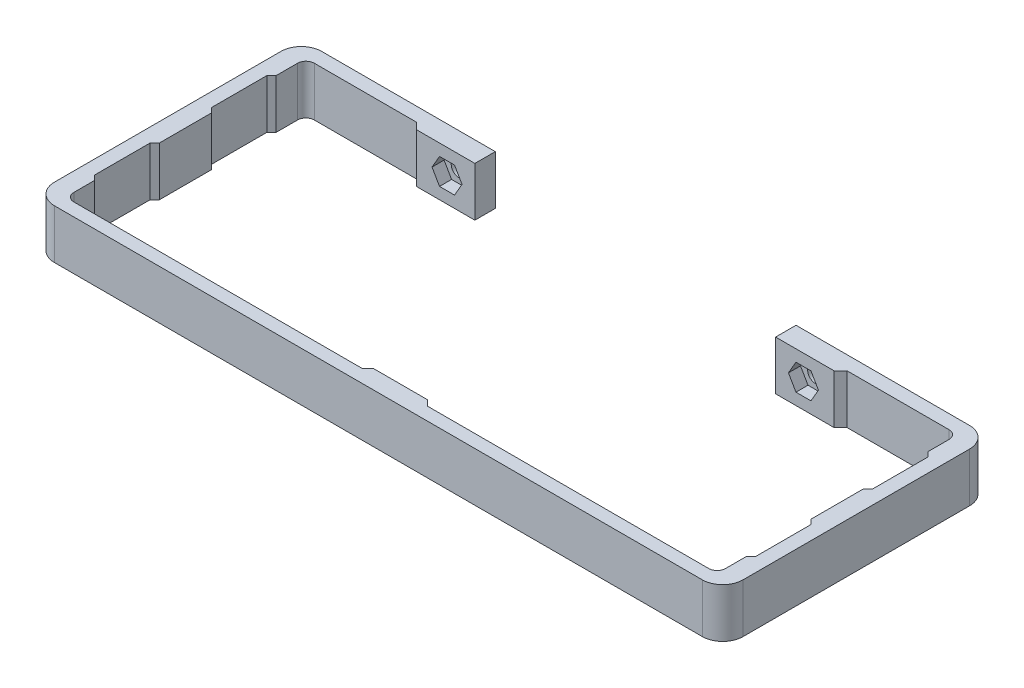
SolidWorks part; units mm, degrees
ref_plane "Front Plane" through (0, 0, 0) normal (0, 0, 1) x (1, 0, 0)
ref_plane "Top Plane" through (0, 0, 0) normal (0, 1, 0) x (1, 0, 0)
ref_plane "Right Plane" through (0, 0, 0) normal (1, 0, 0) x (0, 0, -1)
sketch "Sketch1" plane through (0, 0, 0) normal (0, 0, 1) x (1, 0, 0)
  line L1 (-27.0026, 47.8166) -> (121.3974, 47.8166)
  line L2 (-27.0026, 47.8166) -> (-27.0026, 37.2166)
  line L3 (-27.0026, 37.2166) -> (121.3974, 37.2166)
  line L4 (121.3974, 47.8166) -> (121.3974, 37.2166)
  dimension "D1" = 148.4
  dimension "D2" = 10.6
extrude "Boss-Extrude1" add sketch "Sketch1" along normal blind 4
ref_plane "Plane1" through (0, 0, 0) normal (0, 0, -1) x (-1, 0, 0)
sketch "Sketch2" plane through (0, 0, 0) normal (0, 0, -1) x (-1, 0, 0)
  line L0 (-121.3974, 47.8166) -> (27.0026, 47.8166) construction
  line L1 (-121.3974, 37.2166) -> (-117.3974, 37.2166)
  line L2 (-121.3974, 37.2166) -> (-121.3974, 47.8166)
  line L3 (-121.3974, 47.8166) -> (-117.3974, 47.8166)
  line L4 (-117.3974, 37.2166) -> (-117.3974, 47.8166)
  line L6 (27.0026, 37.2166) -> (23.0026, 37.2166)
  line L7 (27.0026, 37.2166) -> (27.0026, 47.8166)
  line L8 (27.0026, 47.8166) -> (23.0026, 47.8166)
  line L9 (23.0026, 37.2166) -> (23.0026, 47.8166)
  dimension "D1" = 4
  dimension "D2" = 4
extrude "Boss-Extrude2" add sketch "Sketch2" along normal blind 53.6
ref_plane "Plane2" through (0, 47.8166, 0) normal (0, 1, 0) x (1, 0, 0)
sketch "Sketch3" plane through (0, 47.8166, 0) normal (0, 1, 0) x (1, 0, 0)
  line L1 (-23.0026, 53.6) -> (14.7974, 53.6)
  line L2 (-23.0026, 53.6) -> (-23.0026, 49.2)
  line L3 (-23.0026, 49.2) -> (14.7974, 49.2)
  line L4 (14.7974, 53.6) -> (14.7974, 49.2)
  line L5 (117.3974, 53.6) -> (79.5974, 53.6)
  line L6 (117.3974, 53.6) -> (117.3974, 49.2)
  line L7 (117.3974, 49.2) -> (79.5974, 49.2)
  line L8 (79.5974, 53.6) -> (79.5974, 49.2)
  dimension "D1" = 4.4
  dimension "D2" = 4.4
  dimension "D3" = 37.8
  dimension "D4" = 37.8
extrude "Boss-Extrude3" add sketch "Sketch3" against normal blind 10.6
fillet "Fillet1" radius 4.4 4 edges at (121.3974, 42.5166, -53.6) (-27.0026, 42.5166, -53.6) (-27.0026, 42.5166, 4) (121.3974, 42.5166, 4)
ref_plane "Plane3" through (0, 0, -53.6) normal (0, 0, -1) x (-1, 0, 0)
sketch "Sketch4" plane through (0, 0, -53.6) normal (0, 0, -1) x (-1, 0, 0)
  line L0 (-14.7974, 37.2166) -> (-14.7974, 47.8166) construction
  line L1 (22.6026, 47.8166) -> (-14.7974, 47.8166) construction
  line L2 (-79.5974, 47.8166) -> (-116.9974, 47.8166) construction
  line L3 (-79.5974, 37.2166) -> (-79.5974, 47.8166) construction
  circle A0 centre (-8.7974, 42.5166) radius 1.7
  circle A1 centre (-85.5974, 42.5166) radius 1.7
  dimension "D1" = 3.4
  dimension "D2" = 3.4
  dimension "D3" = 6
  dimension "D4" = 5.3
  dimension "D5" = 5.3
  dimension "D6" = 6
extrude "Cut-Extrude1" cut sketch "Sketch4" against normal blind 10.6
ref_plane "Plane4" through (0, 0, -49.2) normal (0, 0, 1) x (1, 0, 0)
sketch "Sketch5" plane through (0, 0, -49.2) normal (0, 0, 1) x (1, 0, 0)
  line L1 (10.414, 39.7166) -> (12.0305, 42.5166)
  line L2 (12.0305, 42.5166) -> (10.414, 45.3166)
  line L3 (10.414, 45.3166) -> (7.1808, 45.3166)
  line L4 (7.1808, 45.3166) -> (5.5642, 42.5166)
  line L5 (5.5642, 42.5166) -> (7.1808, 39.7166)
  line L6 (7.1808, 39.7166) -> (10.414, 39.7166)
  line L7 (87.214, 39.7166) -> (88.8305, 42.5166)
  line L8 (88.8305, 42.5166) -> (87.214, 45.3166)
  line L9 (87.214, 45.3166) -> (83.9808, 45.3166)
  line L10 (83.9808, 45.3166) -> (82.3642, 42.5166)
  line L11 (82.3642, 42.5166) -> (83.9808, 39.7166)
  line L12 (83.9808, 39.7166) -> (87.214, 39.7166)
  circle A0 centre (8.7974, 42.5166) radius 2.8 construction
  circle A1 centre (85.5974, 42.5166) radius 2.8 construction
  dimension "D1" = 5.6
  dimension "D2" = 5.6
extrude "Cut-Extrude2" cut sketch "Sketch5" against normal blind 2.6
sketch "Sketch6" plane through (0, 47.8166, 0) normal (0, 1, 0) x (1, 0, 0)
  line L0 (121.3974, 0.4) -> (121.3974, 49.2) construction
  line L1 (117.3974, 4) -> (118.3974, 4)
  line L2 (117.3974, 4) -> (117.3974, 20)
  line L3 (117.3974, 20) -> (118.3974, 20)
  line L4 (118.3974, 4) -> (118.3974, 20)
  line L5 (117.3974, 45.2) -> (118.3974, 45.2)
  line L6 (117.3974, 45.2) -> (117.3974, 29.2)
  line L7 (117.3974, 29.2) -> (118.3974, 29.2)
  line L8 (118.3974, 45.2) -> (118.3974, 29.2)
  line L9 (117.3974, 49.2) -> (117.3974, 0) construction
  line L10 (-23.0026, 4) -> (-24.0026, 4)
  line L11 (-23.0026, 4) -> (-23.0026, 20)
  line L12 (-23.0026, 20) -> (-24.0026, 20)
  line L13 (-24.0026, 4) -> (-24.0026, 20)
  line L14 (-23.0026, 45.2) -> (-24.0026, 45.2)
  line L15 (-23.0026, 45.2) -> (-23.0026, 29.2)
  line L16 (-23.0026, 29.2) -> (-24.0026, 29.2)
  line L17 (-24.0026, 45.2) -> (-24.0026, 29.2)
  line L18 (-23.0026, 49.2) -> (-23.0026, 0) construction
  line L19 (117.3974, 0) -> (-23.0026, 0) construction
  line L20 (79.5974, 49.2) -> (117.3974, 49.2) construction
  line L21 (-27.0026, 0.4) -> (-27.0026, 49.2) construction
  line L22 (-23.0026, 49.2) -> (14.7974, 49.2) construction
  point P32 (117.8974, 4)
  dimension "D1" = 3
  dimension "D2" = 3
  dimension "D3" = 4
  dimension "D4" = 16
  dimension "D5" = 4
  dimension "D6" = 16
  dimension "D7" = 4
  dimension "D8" = 3
  dimension "D9" = 3
  dimension "D10" = 4
  dimension "D11" = 16
  dimension "D12" = 16
extrude "Cut-Extrude3" cut sketch "Sketch6" against normal blind 13.6
sketch "Sketch7" plane through (0, 47.8166, 0) normal (0, 1, 0) x (1, 0, 0)
  line L0 (116.9974, -4) -> (-22.6026, -4) construction
  line L1 (117.3974, 0) -> (52.9974, 0)
  line L2 (117.3974, 0) -> (117.3974, -1.2)
  line L3 (117.3974, -1.2) -> (52.9974, -1.2)
  line L4 (52.9974, 0) -> (52.9974, -1.2)
  line L5 (-23.0026, 0) -> (42.9974, 0)
  line L6 (-23.0026, 0) -> (-23.0026, -1.2)
  line L7 (-23.0026, -1.2) -> (42.9974, -1.2)
  line L8 (42.9974, 0) -> (42.9974, -1.2)
  line L9 (-22.6026, 53.6) -> (14.7974, 53.6) construction
  line L10 (117.3974, 49.2) -> (91.5974, 49.2)
  line L11 (117.3974, 49.2) -> (117.3974, 50.6)
  line L12 (117.3974, 50.6) -> (91.5974, 50.6)
  line L13 (91.5974, 49.2) -> (91.5974, 50.6)
  line L14 (-23.0026, 49.2) -> (2.7974, 49.2)
  line L15 (-23.0026, 49.2) -> (-23.0026, 50.6)
  line L16 (-23.0026, 50.6) -> (2.7974, 50.6)
  line L17 (2.7974, 49.2) -> (2.7974, 50.6)
  line L18 (79.5974, 53.6) -> (116.9974, 53.6) construction
  line L19 (79.5974, 53.6) -> (79.5974, 49.2) construction
  line L20 (14.7974, 49.2) -> (14.7974, 53.6) construction
  point P26 (91.5974, 49.9)
  point P31 (14.7974, 51.4)
  dimension "D1" = 10
  dimension "D2" = 64.4
  dimension "D3" = 2.8
  dimension "D4" = 2.8
  dimension "D5" = 3
  dimension "D6" = 3
  dimension "D7" = 12
  dimension "D8" = 12
extrude "Cut-Extrude4" cut sketch "Sketch7" against normal blind 13.6
chamfer "Chamfer1" distance 2 angle 45 12 edges at (91.5974, 42.5166, -50.6) (2.7974, 42.5166, -50.6) (118.3974, 42.5166, -45.2) (118.3974, 42.5166, -4) (118.3974, 42.5166, -20) (118.3974, 42.5166, -29.2) (52.9974, 42.5166, 1.2) (42.9974, 42.5166, 1.2) (-24.0026, 42.5166, -20) (-24.0026, 42.5166, -4) (-24.0026, 42.5166, -29.2) (-24.0026, 42.5166, -45.2)
fillet "Fillet2" radius 1.8 4 edges at (117.3974, 42.5166, -50.6) (117.3974, 42.5166, 1.2) (-23.0026, 42.5166, -50.6) (-23.0026, 42.5166, 1.2)
